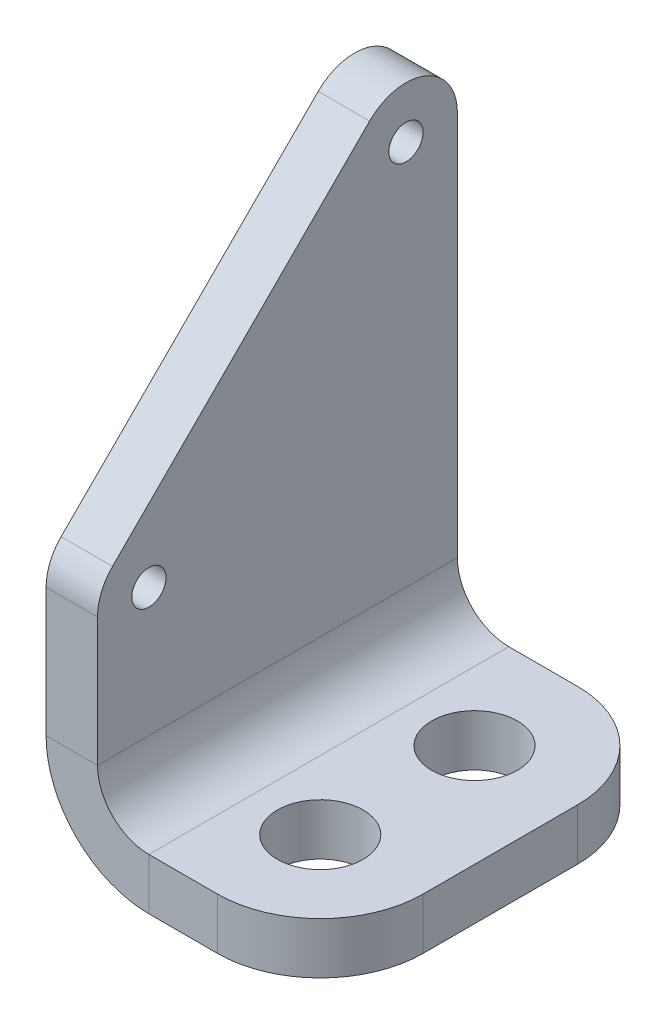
SolidWorks part; units mm, degrees
ref_plane "Frontal" through (0, 0, 0) normal (0, 0, 1) x (1, 0, 0)
ref_plane "Horizontal" through (0, 0, 0) normal (0, 1, 0) x (1, 0, 0)
ref_plane "Vertical" through (0, 0, 0) normal (1, 0, 0) x (0, 0, -1)
sketch "Esquisse1" plane through (0, 0, 0) normal (0, 0, 1) x (1, 0, 0)
  line L0 (0, 0) -> (0, 35)
  line L1 (0, 0) -> (13, 0)
  dimension "D1" = 13
  dimension "D2" = 35
extrude "Base-Extru.-Mince" add sketch "Esquisse1" along normal blind 21 thin
sketch "Esquisse2" plane through (0, 0, 0) normal (0, 1, 0) x (-1, 0, 0)
  line L0 (-7, -0.4934) -> (-7, 26.6717) construction
  line L1 (-13, 21) -> (-13, 0) construction
  line L2 (-13, 10.5) -> (4.6891, 10.5) construction
  circle A0 centre (-7, 6) radius 2.5
  circle A1 centre (-7, 15) radius 2.5
  dimension "D2" = 9
  dimension "D3" = 5
  dimension "D1" = 6
extrude "Enlèv. mat.-Extru.1" cut sketch "Esquisse2" against normal through all
fillet "Congé1" radius 6
sketch "Esquisse3" plane through (0, 0, 0) normal (1, 0, 0) x (0, 0, -1)
  line L0 (-5.1213, 27.6213) -> (-20.1213, 12.6213)
  line L1 (-6, -3) -> (0, -3) construction
  line L3 (0, 25.5) -> (0, 35)
  line L4 (0, 35) -> (-21, 35)
  line L6 (-21, 35) -> (-21, 10.5)
  line L7 (-21, -3) -> (-15, -3) construction
  line L8 (-10.5, 0) -> (-10.5, 37.3615) construction
  line L9 (-15, 0) -> (-6, 0) construction
  circle A0 centre (-18, 10.5) radius 1
  arc A1 (0, 25.5) -> (-5.1213, 27.6213) centre (-3, 25.5) ccw
  arc A2 (-20.1213, 12.6213) -> (-21, 10.5) centre (-18, 10.5) ccw
  circle A3 centre (-3, 25.5) radius 1
  dimension "D4" = 2
  dimension "D5" = 2
  dimension "D6" = 28.5
  dimension "D1" = 13.5
  dimension "D2" = 15
  dimension "D3" = 7.5
extrude "Enlèv. mat.-Extru.2" cut sketch "Esquisse3" against normal through all
sheet metal parameters "Tôlerie 1" parameters "D1"=3
bend "Pli dans angle1" parameters "D1"=0
flatten bends "Dépliage 1" parameters "D1"=0, "D4"=90, "D5"=1
sketch "Esquisse-Angle1" plane through (0, 0, 0) normal (0, 1, 0) x (-1, 0, 0)
  line L0 (0.5343, 0) -> (0.5343, 21) construction
process bends "Pliage 1" parameters "D1"=0
sketch "Esquisse-Plate1" plane through (0, 0, 0) normal (0, 1, 0) x (-1, 0, 0)
